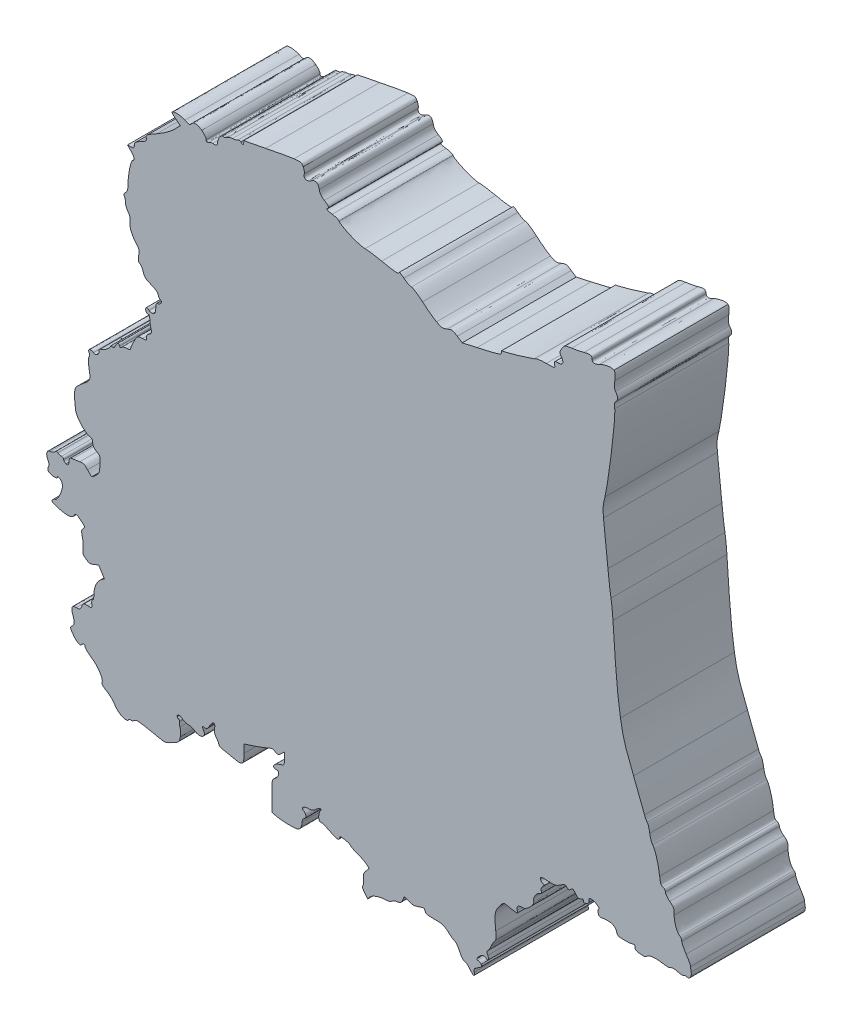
SolidWorks part; units mm, degrees
ref_plane "Plan de face" through (0, 0, 0) normal (1, 0, 0) x (0, 1, 0)
ref_plane "Plan de dessus" through (0, 0, 0) normal (0, 0, 1) x (0, 1, 0)
ref_plane "Plan de droite" through (0, 0, 0) normal (0, 1, 0) x (-1, 0, 0)
sketch "Esquisse1" plane through (0, 0, 0) normal (0, 0, 1) x (0, 1, 0)
  line L0 (-281.1932, -2.654) -> (-281.313, -2.5585)
  line L1 (-281.313, -2.5585) -> (-281.147, -2.4238)
  line L2 (-280.2887, -2.4818) -> (-280.122, -2.622)
  line L3 (-280.122, -2.622) -> (-280.0138, -2.4921)
  line L4 (-280.1697, 1.4705) -> (-280.1142, 1.6503)
  line L5 (-280.1142, 1.6503) -> (-279.4885, 1.6503)
  line L6 (-277.8143, 1.0969) -> (-277.5578, 1.0969)
  line L7 (-277.5578, 1.0969) -> (-277.6876, 1.235)
  line L8 (-277.9887, 2.4113) -> (-278.1392, 2.8678)
  line L9 (-278.1392, 2.8678) -> (-278.4876, 2.8678)
  line L10 (-275.0081, 9.1102) -> (-274.9289, 8.9971)
  line L11 (-274.9289, 8.9971) -> (-274.7314, 9.1192)
  line L12 (-258.0872, 7.8322) -> (-257.932, 7.9809)
  line L13 (-257.932, 7.9809) -> (-257.932, 7.8322)
  line L14 (-256.3209, 5.9341) -> (-256.0468, 5.664)
  line L15 (-256.0468, 5.664) -> (-255.9062, 5.8436)
  line L16 (-257.9679, -6.4873) -> (-258.11, -6.702)
  line L17 (-258.11, -6.702) -> (-257.9649, -7.354)
  line L18 (-277.2068, -16.7182) -> (-277.207, -16.7189)
  spline S0 degree 3 poles (-277.207, -16.7189) (-277.2699, -16.6813) (-277.2944, -16.6224) (-277.2738, -16.5577) knots 0 0 0 0 1 1 1 1
  spline S1 degree 3 poles (-277.2738, -16.5577) (-277.2561, -16.5016) (-277.2636, -16.4419) (-277.2917, -16.4247) knots 0 0 0 0 1 1 1 1
  spline S2 degree 3 poles (-277.2917, -16.4247) (-277.3213, -16.4064) (-277.3173, -16.3011) (-277.2815, -16.1687) knots 0 0 0 0 1 1 1 1
  spline S3 degree 3 poles (-277.2815, -16.1687) (-277.2394, -16.0116) (-277.2389, -15.916) (-277.2785, -15.852) knots 0 0 0 0 1 1 1 1
  spline S4 degree 3 poles (-277.2785, -15.852) (-277.3166, -15.7916) (-277.3193, -15.6664) (-277.2865, -15.4847) knots 0 0 0 0 1 1 1 1
  spline S5 degree 3 poles (-277.2865, -15.4847) (-277.2298, -15.1731) (-277.2702, -14.8656) (-277.3759, -14.8016) knots 0 0 0 0 1 1 1 1
  spline S6 degree 3 poles (-277.3759, -14.8016) (-277.4226, -14.7732) (-277.4389, -14.6778) (-277.4232, -14.5234) knots 0 0 0 0 1 1 1 1
  spline S7 degree 3 poles (-277.4232, -14.5234) (-277.4039, -14.3325) (-277.3784, -14.2881) (-277.288, -14.2881) knots 0 0 0 0 1 1 1 1
  spline S8 degree 3 poles (-277.288, -14.2881) (-277.1982, -14.2881) (-277.1841, -14.2642) (-277.2148, -14.1636) knots 0 0 0 0 1 1 1 1
  spline S9 degree 3 poles (-277.2148, -14.1636) (-277.2358, -14.095) (-277.25, -14.0018) (-277.2466, -13.9561) knots 0 0 0 0 1 1 1 1
  spline S10 degree 3 poles (-277.2466, -13.9561) (-277.2426, -13.9105) (-277.2416, -13.7926) (-277.2426, -13.6942) knots 0 0 0 0 1 1 1 1
  spline S11 degree 3 poles (-277.2426, -13.6942) (-277.2436, -13.5474) (-277.2195, -13.509) (-277.1027, -13.4797) knots 0 0 0 0 1 1 1 1
  spline S12 degree 3 poles (-277.1027, -13.4797) (-276.9227, -13.4344) (-276.8392, -13.2233) (-276.8837, -12.9255) knots 0 0 0 0 1 1 1 1
  spline S13 degree 3 poles (-276.8837, -12.9255) (-276.9142, -12.7213) (-276.9047, -12.6939) (-276.7929, -12.6647) knots 0 0 0 0 1 1 1 1
  spline S14 degree 3 poles (-276.7929, -12.6647) (-276.7242, -12.6466) (-276.6517, -12.6577) (-276.6316, -12.691) knots 0 0 0 0 1 1 1 1
  spline S15 degree 3 poles (-276.6316, -12.691) (-276.5804, -12.7739) (-276.415, -12.5233) (-276.415, -12.3628) knots 0 0 0 0 1 1 1 1
  spline S16 degree 3 poles (-276.415, -12.3628) (-276.415, -12.2621) (-276.4378, -12.2402) (-276.5165, -12.2653) knots 0 0 0 0 1 1 1 1
  spline S17 degree 3 poles (-276.5165, -12.2653) (-276.5888, -12.2884) (-276.6361, -12.2573) (-276.6813, -12.1584) knots 0 0 0 0 1 1 1 1
  spline S18 degree 3 poles (-276.6813, -12.1584) (-276.7338, -12.043) (-276.7303, -12.0192) (-276.661, -12.0192) knots 0 0 0 0 1 1 1 1
  spline S19 degree 3 poles (-276.661, -12.0192) (-276.5936, -12.0192) (-276.5892, -11.997) (-276.6381, -11.9055) knots 0 0 0 0 1 1 1 1
  spline S20 degree 3 poles (-276.6381, -11.9055) (-276.6894, -11.8097) (-276.6761, -11.7738) (-276.5541, -11.6778) knots 0 0 0 0 1 1 1 1
  spline S21 degree 3 poles (-276.5541, -11.6778) (-276.4226, -11.5744) (-276.4171, -11.5553) (-276.4941, -11.4703) knots 0 0 0 0 1 1 1 1
  spline S22 degree 3 poles (-276.4941, -11.4703) (-276.5687, -11.3878) (-276.5691, -11.3668) (-276.4981, -11.2951) knots 0 0 0 0 1 1 1 1
  spline S23 degree 3 poles (-276.4981, -11.2951) (-276.4263, -11.2233) (-276.4338, -11.1883) (-276.5608, -11.0015) knots 0 0 0 0 1 1 1 1
  spline S24 degree 3 poles (-276.5608, -11.0015) (-276.6856, -10.8178) (-276.7018, -10.7456) (-276.6815, -10.4635) knots 0 0 0 0 1 1 1 1
  spline S25 degree 3 poles (-276.6815, -10.4635) (-276.6613, -10.184) (-276.6712, -10.1376) (-276.7524, -10.1376) knots 0 0 0 0 1 1 1 1
  spline S26 degree 3 poles (-276.7524, -10.1376) (-276.8044, -10.1376) (-276.8625, -10.1783) (-276.8816, -10.2282) knots 0 0 0 0 1 1 1 1
  spline S27 degree 3 poles (-276.8816, -10.2282) (-276.9137, -10.3118) (-276.9241, -10.3117) (-277.0178, -10.2272) knots 0 0 0 0 1 1 1 1
  spline S28 degree 3 poles (-277.0178, -10.2272) (-277.0769, -10.1738) (-277.1589, -10.1506) (-277.2137, -10.1715) knots 0 0 0 0 1 1 1 1
  spline S29 degree 3 poles (-277.2137, -10.1715) (-277.2804, -10.1972) (-277.317, -10.1736) (-277.3386, -10.0909) knots 0 0 0 0 1 1 1 1
  spline S30 degree 3 poles (-277.3386, -10.0909) (-277.3727, -9.9603) (-277.6541, -9.7963) (-277.7686, -9.8402) knots 0 0 0 0 1 1 1 1
  spline S31 degree 3 poles (-277.7686, -9.8402) (-277.8902, -9.8868) (-278.2421, -9.5392) (-278.2431, -9.3714) knots 0 0 0 0 1 1 1 1
  spline S32 degree 3 poles (-278.2431, -9.3714) (-278.2441, -9.1531) (-278.3177, -9.068) (-278.4648, -9.1147) knots 0 0 0 0 1 1 1 1
  spline S33 degree 3 poles (-278.4648, -9.1147) (-278.5843, -9.1527) (-278.5887, -9.1441) (-278.5547, -8.9407) knots 0 0 0 0 1 1 1 1
  spline S34 degree 3 poles (-278.5547, -8.9407) (-278.535, -8.8231) (-278.5066, -8.6771) (-278.4915, -8.6162) knots 0 0 0 0 1 1 1 1
  spline S35 degree 3 poles (-278.4915, -8.6162) (-278.4709, -8.533) (-278.5262, -8.4601) (-278.714, -8.323) knots 0 0 0 0 1 1 1 1
  spline S36 degree 3 poles (-278.714, -8.323) (-278.9844, -8.1257) (-279.1736, -8.0979) (-279.7241, -8.1748) knots 0 0 0 0 1 1 1 1
  spline S37 degree 3 poles (-279.7241, -8.1748) (-279.9464, -8.2058) (-280.039, -8.1961) (-280.1115, -8.1344) knots 0 0 0 0 1 1 1 1
  spline S38 degree 3 poles (-280.1115, -8.1344) (-280.1639, -8.0899) (-280.287, -8.0217) (-280.3849, -7.9829) knots 0 0 0 0 1 1 1 1
  spline S39 degree 3 poles (-280.3849, -7.9829) (-280.4829, -7.944) (-280.5905, -7.8792) (-280.6243, -7.8385) knots 0 0 0 0 1 1 1 1
  spline S40 degree 3 poles (-280.6243, -7.8385) (-280.6717, -7.7815) (-280.7163, -7.7785) (-280.82, -7.8256) knots 0 0 0 0 1 1 1 1
  spline S41 degree 3 poles (-280.82, -7.8256) (-280.9677, -7.8929) (-281.064, -7.8462) (-280.9705, -7.7526) knots 0 0 0 0 1 1 1 1
  spline S42 degree 3 poles (-280.9705, -7.7526) (-280.8868, -7.6689) (-280.9391, -7.5258) (-281.0962, -7.4097) knots 0 0 0 0 1 1 1 1
  spline S43 degree 3 poles (-281.0962, -7.4097) (-281.203, -7.3308) (-281.2307, -7.3265) (-281.2307, -7.389) knots 0 0 0 0 1 1 1 1
  spline S44 degree 3 poles (-281.2307, -7.389) (-281.2307, -7.4324) (-281.2654, -7.4966) (-281.3079, -7.5319) knots 0 0 0 0 1 1 1 1
  spline S45 degree 3 poles (-281.3079, -7.5319) (-281.3698, -7.5834) (-281.4096, -7.5563) (-281.5087, -7.3961) knots 0 0 0 0 1 1 1 1
  spline S46 degree 3 poles (-281.5087, -7.3961) (-281.6101, -7.2322) (-281.6559, -7.2022) (-281.7635, -7.2291) knots 0 0 0 0 1 1 1 1
  spline S47 degree 3 poles (-281.7635, -7.2291) (-281.9448, -7.2747) (-281.9278, -7.1771) (-281.7288, -7.0299) knots 0 0 0 0 1 1 1 1
  spline S48 degree 3 poles (-281.7288, -7.0299) (-281.6374, -6.9624) (-281.5628, -6.8639) (-281.5628, -6.811) knots 0 0 0 0 1 1 1 1
  spline S49 degree 3 poles (-281.5628, -6.811) (-281.5628, -6.7499) (-281.4625, -6.668) (-281.2883, -6.5862) knots 0 0 0 0 1 1 1 1
  spline S50 degree 3 poles (-281.2883, -6.5862) (-281.1374, -6.5156) (-281.0129, -6.4265) (-281.0116, -6.3885) knots 0 0 0 0 1 1 1 1
  spline S51 degree 3 poles (-281.0116, -6.3885) (-281.0106, -6.3504) (-280.9236, -6.2246) (-280.8188, -6.1086) knots 0 0 0 0 1 1 1 1
  spline S52 degree 3 poles (-280.8188, -6.1086) (-280.6767, -5.9513) (-280.6275, -5.8459) (-280.6252, -5.6934) knots 0 0 0 0 1 1 1 1
  spline S53 degree 3 poles (-280.6252, -5.6934) (-280.6162, -5.1185) (-280.6135, -5.1066) (-280.5114, -5.074) knots 0 0 0 0 1 1 1 1
  spline S54 degree 3 poles (-280.5114, -5.074) (-280.4155, -5.0436) (-280.4142, -5.0263) (-280.4911, -4.8007) knots 0 0 0 0 1 1 1 1
  spline S55 degree 3 poles (-280.4911, -4.8007) (-280.5639, -4.5869) (-280.5637, -4.5374) (-280.4881, -4.358) knots 0 0 0 0 1 1 1 1
  spline S56 degree 3 poles (-280.4881, -4.358) (-280.4104, -4.1719) (-280.4111, -4.1537) (-280.4985, -4.1268) knots 0 0 0 0 1 1 1 1
  spline S57 degree 3 poles (-280.4985, -4.1268) (-280.7027, -4.064) (-280.7602, -4.005) (-280.7766, -3.8412) knots 0 0 0 0 1 1 1 1
  spline S58 degree 3 poles (-280.7766, -3.8412) (-280.7856, -3.7475) (-280.8296, -3.6412) (-280.8735, -3.6048) knots 0 0 0 0 1 1 1 1
  spline S59 degree 3 poles (-280.8735, -3.6048) (-280.9174, -3.5685) (-280.9534, -3.4607) (-280.9536, -3.3654) knots 0 0 0 0 1 1 1 1
  spline S60 degree 3 poles (-280.9536, -3.3654) (-280.954, -3.0846) (-281.0645, -2.7567) (-281.1932, -2.654) knots 0 0 0 0 1 1 1 1
  spline S61 degree 3 poles (-281.147, -2.4238) (-281.0269, -2.3264) (-280.9617, -2.3052) (-280.9113, -2.3466) knots 0 0 0 0 1 1 1 1
  spline S62 degree 3 poles (-280.9113, -2.3466) (-280.8729, -2.3784) (-280.7548, -2.3901) (-280.6485, -2.3729) knots 0 0 0 0 1 1 1 1
  spline S63 degree 3 poles (-280.6485, -2.3729) (-280.4944, -2.3479) (-280.4217, -2.3708) (-280.2887, -2.4818) knots 0 0 0 0 1 1 1 1
  spline S64 degree 3 poles (-280.0138, -2.4921) (-279.9543, -2.4206) (-279.8654, -2.244) (-279.8163, -2.0996) knots 0 0 0 0 1 1 1 1
  spline S65 degree 3 poles (-279.8163, -2.0996) (-279.7672, -1.9552) (-279.6948, -1.8183) (-279.6554, -1.7953) knots 0 0 0 0 1 1 1 1
  spline S66 degree 3 poles (-279.6554, -1.7953) (-279.5859, -1.7547) (-279.5057, -1.3392) (-279.567, -1.3375) knots 0 0 0 0 1 1 1 1
  spline S67 degree 3 poles (-279.567, -1.3375) (-279.5837, -1.3371) (-279.6306, -1.3156) (-279.6713, -1.2898) knots 0 0 0 0 1 1 1 1
  spline S68 degree 3 poles (-279.6713, -1.2898) (-279.7299, -1.2526) (-279.7092, -1.1716) (-279.5707, -0.8975) knots 0 0 0 0 1 1 1 1
  spline S69 degree 3 poles (-279.5707, -0.8975) (-279.4748, -0.7075) (-279.409, -0.519) (-279.4245, -0.4785) knots 0 0 0 0 1 1 1 1
  spline S70 degree 3 poles (-279.4245, -0.4785) (-279.4586, -0.3896) (-279.1384, -0.3811) (-279.0288, -0.4679) knots 0 0 0 0 1 1 1 1
  spline S71 degree 3 poles (-279.0288, -0.4679) (-278.8864, -0.581) (-278.8906, -0.4467) (-279.0338, -0.297) knots 0 0 0 0 1 1 1 1
  spline S72 degree 3 poles (-279.0338, -0.297) (-279.1383, -0.188) (-279.182, -0.0837) (-279.182, 0.0563) knots 0 0 0 0 1 1 1 1
  spline S73 degree 3 poles (-279.182, 0.0563) (-279.182, 0.265) (-279.3242, 0.3932) (-279.3837, 0.2381) knots 0 0 0 0 1 1 1 1
  spline S74 degree 3 poles (-279.3837, 0.2381) (-279.4246, 0.1312) (-279.619, 0.132) (-279.6601, 0.239) knots 0 0 0 0 1 1 1 1
  spline S75 degree 3 poles (-279.6601, 0.239) (-279.6775, 0.2846) (-279.7584, 0.3221) (-279.8397, 0.3221) knots 0 0 0 0 1 1 1 1
  spline S76 degree 3 poles (-279.8397, 0.3221) (-279.9209, 0.3221) (-280.0405, 0.3592) (-280.1052, 0.4046) knots 0 0 0 0 1 1 1 1
  spline S77 degree 3 poles (-280.1052, 0.4046) (-280.2067, 0.4757) (-280.2231, 0.5424) (-280.224, 0.8888) knots 0 0 0 0 1 1 1 1
  spline S78 degree 3 poles (-280.224, 0.8888) (-280.2245, 1.1098) (-280.2002, 1.3715) (-280.1697, 1.4705) knots 0 0 0 0 1 1 1 1
  spline S79 degree 3 poles (-279.4885, 1.6503) (-278.891, 1.6503) (-278.8588, 1.6433) (-278.7767, 1.5191) knots 0 0 0 0 1 1 1 1
  spline S80 degree 3 poles (-278.7767, 1.5191) (-278.7294, 1.447) (-278.6269, 1.3756) (-278.5489, 1.3607) knots 0 0 0 0 1 1 1 1
  spline S81 degree 3 poles (-278.5489, 1.3607) (-278.4306, 1.3381) (-278.4072, 1.3537) (-278.4072, 1.4591) knots 0 0 0 0 1 1 1 1
  spline S82 degree 3 poles (-278.4072, 1.4591) (-278.4072, 1.6698) (-278.2109, 1.5648) (-278.1357, 1.3137) knots 0 0 0 0 1 1 1 1
  spline S83 degree 3 poles (-278.1357, 1.3137) (-278.0723, 1.102) (-278.0646, 1.0969) (-277.8143, 1.0969) knots 0 0 0 0 1 1 1 1
  spline S84 degree 3 poles (-277.6876, 1.235) (-277.8016, 1.3564) (-277.8089, 1.3891) (-277.7472, 1.5042) knots 0 0 0 0 1 1 1 1
  spline S85 degree 3 poles (-277.7472, 1.5042) (-277.6895, 1.612) (-277.6913, 1.6636) (-277.7575, 1.795) knots 0 0 0 0 1 1 1 1
  spline S86 degree 3 poles (-277.7575, 1.795) (-277.8019, 1.8829) (-277.906, 2.1602) (-277.9887, 2.4113) knots 0 0 0 0 1 1 1 1
  spline S87 degree 3 poles (-278.4876, 2.8678) (-278.9424, 2.8678) (-278.9989, 2.9291) (-278.9082, 3.325) knots 0 0 0 0 1 1 1 1
  spline S88 degree 3 poles (-278.9082, 3.325) (-278.8717, 3.4845) (-278.8284, 3.6959) (-278.8119, 3.7948) knots 0 0 0 0 1 1 1 1
  spline S89 degree 3 poles (-278.8119, 3.7948) (-278.7954, 3.8936) (-278.7507, 3.9747) (-278.7125, 3.9747) knots 0 0 0 0 1 1 1 1
  spline S90 degree 3 poles (-278.7125, 3.9747) (-278.6743, 3.9747) (-278.5799, 4.0243) (-278.5027, 4.0851) knots 0 0 0 0 1 1 1 1
  spline S91 degree 3 poles (-278.5027, 4.0851) (-278.4024, 4.164) (-278.3153, 4.1862) (-278.1975, 4.1626) knots 0 0 0 0 1 1 1 1
  spline S92 degree 3 poles (-278.1975, 4.1626) (-277.9428, 4.1117) (-277.9373, 4.2294) (-278.1886, 4.3703) knots 0 0 0 0 1 1 1 1
  spline S93 degree 3 poles (-278.1886, 4.3703) (-278.3506, 4.4614) (-278.4068, 4.5247) (-278.3882, 4.5956) knots 0 0 0 0 1 1 1 1
  spline S94 degree 3 poles (-278.3882, 4.5956) (-278.3583, 4.7103) (-278.3752, 4.7153) (-278.5253, 4.6351) knots 0 0 0 0 1 1 1 1
  spline S95 degree 3 poles (-278.5253, 4.6351) (-278.7507, 4.5145) (-278.8857, 4.8185) (-278.71, 5.0508) knots 0 0 0 0 1 1 1 1
  spline S96 degree 3 poles (-278.71, 5.0508) (-278.6653, 5.1099) (-278.6287, 5.2234) (-278.6287, 5.3031) knots 0 0 0 0 1 1 1 1
  spline S97 degree 3 poles (-278.6287, 5.3031) (-278.6287, 5.3828) (-278.5921, 5.4963) (-278.5475, 5.5554) knots 0 0 0 0 1 1 1 1
  spline S98 degree 3 poles (-278.5475, 5.5554) (-278.4421, 5.6949) (-278.4413, 5.8011) (-278.5465, 5.8011) knots 0 0 0 0 1 1 1 1
  spline S99 degree 3 poles (-278.5465, 5.8011) (-278.5921, 5.8011) (-278.6296, 5.774) (-278.6296, 5.7411) knots 0 0 0 0 1 1 1 1
  spline S100 degree 3 poles (-278.6296, 5.7411) (-278.6296, 5.7082) (-278.6607, 5.6921) (-278.6988, 5.7055) knots 0 0 0 0 1 1 1 1
  spline S101 degree 3 poles (-278.6988, 5.7055) (-278.7369, 5.7189) (-278.8282, 5.7075) (-278.9015, 5.6804) knots 0 0 0 0 1 1 1 1
  spline S102 degree 3 poles (-278.9015, 5.6804) (-278.975, 5.6532) (-279.1385, 5.6464) (-279.2649, 5.6655) knots 0 0 0 0 1 1 1 1
  spline S103 degree 3 poles (-279.2649, 5.6655) (-279.476, 5.6972) (-279.5086, 5.7256) (-279.6628, 6.0135) knots 0 0 0 0 1 1 1 1
  spline S104 degree 3 poles (-279.6628, 6.0135) (-279.8066, 6.2816) (-279.8236, 6.3549) (-279.7808, 6.5206) knots 0 0 0 0 1 1 1 1
  spline S105 degree 3 poles (-279.7808, 6.5206) (-279.7532, 6.6271) (-279.6958, 6.9128) (-279.653, 7.1555) knots 0 0 0 0 1 1 1 1
  spline S106 degree 3 poles (-279.653, 7.1555) (-279.5839, 7.548) (-279.5848, 7.6071) (-279.661, 7.6916) knots 0 0 0 0 1 1 1 1
  spline S107 degree 3 poles (-279.661, 7.6916) (-279.7083, 7.7438) (-279.7315, 7.8114) (-279.7127, 7.842) knots 0 0 0 0 1 1 1 1
  spline S108 degree 3 poles (-279.7127, 7.842) (-279.6939, 7.8723) (-279.7167, 7.9187) (-279.7627, 7.9445) knots 0 0 0 0 1 1 1 1
  spline S109 degree 3 poles (-279.7627, 7.9445) (-279.9021, 8.0224) (-279.7188, 8.4119) (-279.4829, 8.539) knots 0 0 0 0 1 1 1 1
  spline S110 degree 3 poles (-279.4829, 8.539) (-279.3788, 8.5949) (-279.2297, 8.7501) (-279.1514, 8.8838) knots 0 0 0 0 1 1 1 1
  spline S111 degree 3 poles (-279.1514, 8.8838) (-279.0479, 9.0605) (-278.9831, 9.1185) (-278.9139, 9.0965) knots 0 0 0 0 1 1 1 1
  spline S112 degree 3 poles (-278.9139, 9.0965) (-278.7464, 9.0434) (-278.4026, 9.2694) (-278.2054, 9.5622) knots 0 0 0 0 1 1 1 1
  spline S113 degree 3 poles (-278.2054, 9.5622) (-278.1021, 9.7156) (-277.9809, 9.8412) (-277.936, 9.8412) knots 0 0 0 0 1 1 1 1
  spline S114 degree 3 poles (-277.936, 9.8412) (-277.8432, 9.8412) (-277.8268, 9.9282) (-277.9098, 9.9795) knots 0 0 0 0 1 1 1 1
  spline S115 degree 3 poles (-277.9098, 9.9795) (-278.025, 10.0506) (-277.9549, 10.2064) (-277.7393, 10.359) knots 0 0 0 0 1 1 1 1
  spline S116 degree 3 poles (-277.7393, 10.359) (-277.5454, 10.4962) (-277.507, 10.5063) (-277.4499, 10.4346) knots 0 0 0 0 1 1 1 1
  spline S117 degree 3 poles (-277.4499, 10.4346) (-277.3488, 10.3078) (-277.238, 10.2935) (-276.9991, 10.3765) knots 0 0 0 0 1 1 1 1
  spline S118 degree 3 poles (-276.9991, 10.3765) (-276.7192, 10.4741) (-276.637, 10.4398) (-276.637, 10.2253) knots 0 0 0 0 1 1 1 1
  spline S119 degree 3 poles (-276.637, 10.2253) (-276.637, 10.0837) (-276.6067, 10.0413) (-276.4678, 9.9889) knots 0 0 0 0 1 1 1 1
  spline S120 degree 3 poles (-276.4678, 9.9889) (-276.3183, 9.9325) (-276.3005, 9.9026) (-276.3141, 9.7308) knots 0 0 0 0 1 1 1 1
  spline S121 degree 3 poles (-276.3141, 9.7308) (-276.329, 9.5433) (-276.3231, 9.5371) (-276.1511, 9.5506) knots 0 0 0 0 1 1 1 1
  spline S122 degree 3 poles (-276.1511, 9.5506) (-276.053, 9.5586) (-275.9728, 9.54) (-275.9728, 9.5092) knots 0 0 0 0 1 1 1 1
  spline S123 degree 3 poles (-275.9728, 9.5092) (-275.9728, 9.4787) (-275.8575, 9.4536) (-275.7165, 9.4536) knots 0 0 0 0 1 1 1 1
  spline S124 degree 3 poles (-275.7165, 9.4536) (-275.4431, 9.4536) (-275.1487, 9.3109) (-275.0081, 9.1102) knots 0 0 0 0 1 1 1 1
  spline S125 degree 3 poles (-274.7314, 9.1192) (-274.6228, 9.1862) (-274.5339, 9.2488) (-274.5339, 9.258) knots 0 0 0 0 1 1 1 1
  spline S126 degree 3 poles (-274.5339, 9.258) (-274.5339, 9.267) (-274.5689, 9.3581) (-274.6117, 9.4599) knots 0 0 0 0 1 1 1 1
  spline S127 degree 3 poles (-274.6117, 9.4599) (-274.6827, 9.6288) (-274.6797, 9.6587) (-274.5761, 9.8042) knots 0 0 0 0 1 1 1 1
  spline S128 degree 3 poles (-274.5761, 9.8042) (-274.4774, 9.9429) (-274.4373, 9.9594) (-274.2666, 9.9317) knots 0 0 0 0 1 1 1 1
  spline S129 degree 3 poles (-274.2666, 9.9317) (-274.1588, 9.9142) (-273.9624, 9.9277) (-273.8301, 9.9605) knots 0 0 0 0 1 1 1 1
  spline S130 degree 3 poles (-273.8301, 9.9605) (-273.6265, 10.0119) (-273.5741, 10.007) (-273.4876, 9.9286) knots 0 0 0 0 1 1 1 1
  spline S131 degree 3 poles (-273.4876, 9.9286) (-273.3913, 9.8413) (-273.3775, 9.8459) (-273.2403, 10.0089) knots 0 0 0 0 1 1 1 1
  spline S132 degree 3 poles (-273.2403, 10.0089) (-273.066, 10.2161) (-273.0612, 10.2617) (-273.2057, 10.3391) knots 0 0 0 0 1 1 1 1
  spline S133 degree 3 poles (-273.2057, 10.3391) (-273.3448, 10.4134) (-273.3535, 10.7086) (-273.2275, 11.0782) knots 0 0 0 0 1 1 1 1
  spline S134 degree 3 poles (-273.2275, 11.0782) (-273.1551, 11.2907) (-273.1244, 11.3272) (-273.0615, 11.275) knots 0 0 0 0 1 1 1 1
  spline S135 degree 3 poles (-273.0615, 11.275) (-273.019, 11.2398) (-272.9843, 11.1815) (-272.9843, 11.1458) knots 0 0 0 0 1 1 1 1
  spline S136 degree 3 poles (-272.9843, 11.1458) (-272.9843, 11.0546) (-272.5168, 10.8372) (-272.3206, 10.8372) knots 0 0 0 0 1 1 1 1
  spline S137 degree 3 poles (-272.3206, 10.8372) (-272.2146, 10.8372) (-272.1374, 10.8758) (-272.0988, 10.9479) knots 0 0 0 0 1 1 1 1
  spline S138 degree 3 poles (-272.0988, 10.9479) (-272.0586, 11.023) (-272.058, 11.0586) (-272.0976, 11.0586) knots 0 0 0 0 1 1 1 1
  spline S139 degree 3 poles (-272.0976, 11.0586) (-272.1844, 11.0586) (-272.1661, 11.3677) (-272.0748, 11.4436) knots 0 0 0 0 1 1 1 1
  spline S140 degree 3 poles (-272.0748, 11.4436) (-272.0193, 11.4895) (-271.9645, 11.4931) (-271.8966, 11.4552) knots 0 0 0 0 1 1 1 1
  spline S141 degree 3 poles (-271.8966, 11.4552) (-271.8281, 11.4169) (-271.7549, 11.423) (-271.6532, 11.4756) knots 0 0 0 0 1 1 1 1
  spline S142 degree 3 poles (-271.6532, 11.4756) (-271.4561, 11.5777) (-271.2694, 11.5229) (-271.2694, 11.3634) knots 0 0 0 0 1 1 1 1
  spline S143 degree 3 poles (-271.2694, 11.3634) (-271.2694, 11.2945) (-271.2309, 11.2064) (-271.184, 11.1675) knots 0 0 0 0 1 1 1 1
  spline S144 degree 3 poles (-271.184, 11.1675) (-271.1248, 11.1184) (-271.1164, 11.0789) (-271.1563, 11.0389) knots 0 0 0 0 1 1 1 1
  spline S145 degree 3 poles (-271.1563, 11.0389) (-271.188, 11.0071) (-271.214, 10.9364) (-271.214, 10.8816) knots 0 0 0 0 1 1 1 1
  spline S146 degree 3 poles (-271.214, 10.8816) (-271.214, 10.8267) (-271.2484, 10.782) (-271.2905, 10.782) knots 0 0 0 0 1 1 1 1
  spline S147 degree 3 poles (-271.2905, 10.782) (-271.3327, 10.782) (-271.3798, 10.7336) (-271.3952, 10.6744) knots 0 0 0 0 1 1 1 1
  spline S148 degree 3 poles (-271.3952, 10.6744) (-271.4182, 10.5867) (-271.3913, 10.5636) (-271.2495, 10.5498) knots 0 0 0 0 1 1 1 1
  spline S149 degree 3 poles (-271.2495, 10.5498) (-271.1084, 10.5361) (-271.074, 10.5069) (-271.0668, 10.3946) knots 0 0 0 0 1 1 1 1
  spline S150 degree 3 poles (-271.0668, 10.3946) (-271.0616, 10.3185) (-271.0402, 10.1757) (-271.0186, 10.0772) knots 0 0 0 0 1 1 1 1
  spline S151 degree 3 poles (-271.0186, 10.0772) (-270.9845, 9.9224) (-271.0026, 9.8764) (-271.152, 9.7368) knots 0 0 0 0 1 1 1 1
  spline S152 degree 3 poles (-271.152, 9.7368) (-271.2469, 9.648) (-271.3247, 9.5641) (-271.3247, 9.5503) knots 0 0 0 0 1 1 1 1
  spline S153 degree 3 poles (-271.3247, 9.5503) (-271.3247, 9.5366) (-271.2588, 9.454) (-271.1781, 9.3671) knots 0 0 0 0 1 1 1 1
  spline S154 degree 3 poles (-271.1781, 9.3671) (-271.054, 9.2331) (-270.9799, 9.2057) (-270.6939, 9.1879) knots 0 0 0 0 1 1 1 1
  spline S155 degree 3 poles (-270.6939, 9.1879) (-270.366, 9.1673) (-270.3534, 9.1718) (-270.2563, 9.338) knots 0 0 0 0 1 1 1 1
  spline S156 degree 3 poles (-270.2563, 9.338) (-270.1832, 9.4631) (-270.1156, 9.5091) (-270.0052, 9.5091) knots 0 0 0 0 1 1 1 1
  spline S157 degree 3 poles (-270.0052, 9.5091) (-269.89, 9.5091) (-269.8519, 9.5376) (-269.845, 9.6287) knots 0 0 0 0 1 1 1 1
  spline S158 degree 3 poles (-269.845, 9.6287) (-269.8307, 9.8188) (-269.4077, 10.2123) (-269.1739, 10.253) knots 0 0 0 0 1 1 1 1
  spline S159 degree 3 poles (-269.1739, 10.253) (-268.7888, 10.3199) (-268.4185, 10.3242) (-268.3007, 10.2636) knots 0 0 0 0 1 1 1 1
  spline S160 degree 3 poles (-268.3007, 10.2636) (-268.2355, 10.2296) (-268.0793, 10.071) (-267.9535, 9.9112) knots 0 0 0 0 1 1 1 1
  spline S161 degree 3 poles (-267.9535, 9.9112) (-267.709, 9.6005) (-267.6792, 9.5907) (-267.2323, 9.6754) knots 0 0 0 0 1 1 1 1
  spline S162 degree 3 poles (-267.2323, 9.6754) (-267.034, 9.7131) (-266.909, 9.7117) (-266.8338, 9.6724) knots 0 0 0 0 1 1 1 1
  spline S163 degree 3 poles (-266.8338, 9.6724) (-266.7561, 9.631) (-266.7031, 9.6314) (-266.6513, 9.6734) knots 0 0 0 0 1 1 1 1
  spline S164 degree 3 poles (-266.6513, 9.6734) (-266.5533, 9.7548) (-266.483, 9.5813) (-266.5711, 9.4751) knots 0 0 0 0 1 1 1 1
  spline S165 degree 3 poles (-266.5711, 9.4751) (-266.6513, 9.3786) (-266.5439, 9.2331) (-266.3924, 9.2331) knots 0 0 0 0 1 1 1 1
  spline S166 degree 3 poles (-266.3924, 9.2331) (-266.3353, 9.2331) (-266.2886, 9.2035) (-266.2886, 9.1675) knots 0 0 0 0 1 1 1 1
  spline S167 degree 3 poles (-266.2886, 9.1675) (-266.2886, 9.0651) (-266.0474, 8.736) (-265.9721, 8.7355) knots 0 0 0 0 1 1 1 1
  spline S168 degree 3 poles (-265.9721, 8.7355) (-265.935, 8.7353) (-265.9188, 8.6983) (-265.9362, 8.6532) knots 0 0 0 0 1 1 1 1
  spline S169 degree 3 poles (-265.9362, 8.6532) (-265.9563, 8.601) (-265.9157, 8.5479) (-265.8237, 8.506) knots 0 0 0 0 1 1 1 1
  spline S170 degree 3 poles (-265.8237, 8.506) (-265.6675, 8.4348) (-265.6404, 8.3713) (-265.7489, 8.3314) knots 0 0 0 0 1 1 1 1
  spline S171 degree 3 poles (-265.7489, 8.3314) (-265.8042, 8.3112) (-265.8042, 8.2913) (-265.7489, 8.2327) knots 0 0 0 0 1 1 1 1
  spline S172 degree 3 poles (-265.7489, 8.2327) (-265.7107, 8.1923) (-265.6797, 8.0897) (-265.6797, 8.0045) knots 0 0 0 0 1 1 1 1
  spline S173 degree 3 poles (-265.6797, 8.0045) (-265.6797, 7.9184) (-265.6494, 7.8495) (-265.6114, 7.8495) knots 0 0 0 0 1 1 1 1
  spline S174 degree 3 poles (-265.6114, 7.8495) (-265.5738, 7.8495) (-265.412, 7.7809) (-265.2518, 7.6973) knots 0 0 0 0 1 1 1 1
  spline S175 degree 3 poles (-265.2518, 7.6973) (-264.9769, 7.5536) (-264.9605, 7.5331) (-264.9604, 7.3311) knots 0 0 0 0 1 1 1 1
  spline S176 degree 3 poles (-264.9604, 7.3311) (-264.9603, 7.1461) (-264.9457, 7.121) (-264.8521, 7.1454) knots 0 0 0 0 1 1 1 1
  spline S177 degree 3 poles (-264.8521, 7.1454) (-264.7786, 7.1645) (-264.7155, 7.1303) (-264.6553, 7.0384) knots 0 0 0 0 1 1 1 1
  spline S178 degree 3 poles (-264.6553, 7.0384) (-264.5886, 6.9364) (-264.5374, 6.9124) (-264.4478, 6.9409) knots 0 0 0 0 1 1 1 1
  spline S179 degree 3 poles (-264.4478, 6.9409) (-264.3483, 6.9726) (-264.2039, 6.994) (-263.9502, 7.0159) knots 0 0 0 0 1 1 1 1
  spline S180 degree 3 poles (-263.9502, 7.0159) (-263.9272, 7.0168) (-263.9088, 7.0568) (-263.9088, 7.1024) knots 0 0 0 0 1 1 1 1
  spline S181 degree 3 poles (-263.9088, 7.1024) (-263.9088, 7.1486) (-263.8595, 7.1855) (-263.7981, 7.1855) knots 0 0 0 0 1 1 1 1
  spline S182 degree 3 poles (-263.7981, 7.1855) (-263.675, 7.1855) (-263.656, 7.1284) (-263.7482, 7.0361) knots 0 0 0 0 1 1 1 1
  spline S183 degree 3 poles (-263.7482, 7.0361) (-263.7816, 7.0027) (-263.7924, 6.9229) (-263.7722, 6.859) knots 0 0 0 0 1 1 1 1
  spline S184 degree 3 poles (-263.7722, 6.859) (-263.7428, 6.7668) (-263.6901, 6.7428) (-263.5177, 6.7428) knots 0 0 0 0 1 1 1 1
  spline S185 degree 3 poles (-263.5177, 6.7428) (-263.3697, 6.7428) (-263.3, 6.7185) (-263.3, 6.6666) knots 0 0 0 0 1 1 1 1
  spline S186 degree 3 poles (-263.3, 6.6666) (-263.3, 6.6246) (-263.2646, 6.5609) (-263.2216, 6.5252) knots 0 0 0 0 1 1 1 1
  spline S187 degree 3 poles (-263.2216, 6.5252) (-263.1604, 6.4744) (-263.1329, 6.4775) (-263.0971, 6.5399) knots 0 0 0 0 1 1 1 1
  spline S188 degree 3 poles (-263.0971, 6.5399) (-263.072, 6.5839) (-263.0022, 6.6289) (-262.9423, 6.6401) knots 0 0 0 0 1 1 1 1
  spline S189 degree 3 poles (-262.9423, 6.6401) (-262.8703, 6.6536) (-262.7961, 6.757) (-262.7233, 6.9453) knots 0 0 0 0 1 1 1 1
  spline S190 degree 3 poles (-262.7233, 6.9453) (-262.6286, 7.1901) (-262.5847, 7.2387) (-262.4091, 7.2913) knots 0 0 0 0 1 1 1 1
  spline S191 degree 3 poles (-262.4091, 7.2913) (-262.2967, 7.325) (-262.1895, 7.3924) (-262.1708, 7.4412) knots 0 0 0 0 1 1 1 1
  spline S192 degree 3 poles (-262.1708, 7.4412) (-262.1435, 7.5124) (-262.0882, 7.5226) (-261.8895, 7.4928) knots 0 0 0 0 1 1 1 1
  spline S193 degree 3 poles (-261.8895, 7.4928) (-261.6817, 7.4618) (-261.6222, 7.4746) (-261.5166, 7.5744) knots 0 0 0 0 1 1 1 1
  spline S194 degree 3 poles (-261.5166, 7.5744) (-261.2935, 7.7851) (-260.9881, 7.9121) (-260.7925, 7.8754) knots 0 0 0 0 1 1 1 1
  spline S195 degree 3 poles (-260.7925, 7.8754) (-260.6589, 7.8504) (-260.576, 7.8724) (-260.4675, 7.9563) knots 0 0 0 0 1 1 1 1
  spline S196 degree 3 poles (-260.4675, 7.9563) (-260.3873, 8.0193) (-260.2499, 8.0709) (-260.1619, 8.0709) knots 0 0 0 0 1 1 1 1
  spline S197 degree 3 poles (-260.1619, 8.0709) (-260.0739, 8.0709) (-259.9763, 8.0964) (-259.9452, 8.1276) knots 0 0 0 0 1 1 1 1
  spline S198 degree 3 poles (-259.9452, 8.1276) (-259.9066, 8.1662) (-259.8563, 8.1486) (-259.7872, 8.0722) knots 0 0 0 0 1 1 1 1
  spline S199 degree 3 poles (-259.7872, 8.0722) (-259.7141, 7.9912) (-259.6165, 7.9602) (-259.436, 7.9602) knots 0 0 0 0 1 1 1 1
  spline S200 degree 3 poles (-259.436, 7.9602) (-259.054, 7.9602) (-258.4631, 7.8441) (-258.4135, 7.7592) knots 0 0 0 0 1 1 1 1
  spline S201 degree 3 poles (-258.4135, 7.7592) (-258.3479, 7.6468) (-258.2604, 7.6664) (-258.0872, 7.8322) knots 0 0 0 0 1 1 1 1
  spline S202 degree 3 poles (-257.932, 7.8322) (-257.932, 7.7107) (-257.907, 7.6834) (-257.7946, 7.6834) knots 0 0 0 0 1 1 1 1
  spline S203 degree 3 poles (-257.7946, 7.6834) (-257.6852, 7.6834) (-257.6285, 7.6267) (-257.5166, 7.406) knots 0 0 0 0 1 1 1 1
  spline S204 degree 3 poles (-257.5166, 7.406) (-257.3985, 7.1731) (-257.3562, 7.1332) (-257.2528, 7.1576) knots 0 0 0 0 1 1 1 1
  spline S205 degree 3 poles (-257.2528, 7.1576) (-257.1453, 7.183) (-257.0955, 7.124) (-256.8623, 6.6954) knots 0 0 0 0 1 1 1 1
  spline S206 degree 3 poles (-256.8623, 6.6954) (-256.7114, 6.418) (-256.4757, 6.0865) (-256.3209, 5.9341) knots 0 0 0 0 1 1 1 1
  spline S207 degree 3 poles (-255.9062, 5.8436) (-255.8288, 5.9423) (-255.7441, 6.0232) (-255.7178, 6.0232) knots 0 0 0 0 1 1 1 1
  spline S208 degree 3 poles (-255.7178, 6.0232) (-255.6261, 6.0232) (-255.6336, 5.6619) (-255.7295, 5.4613) knots 0 0 0 0 1 1 1 1
  spline S209 degree 3 poles (-255.7295, 5.4613) (-255.8129, 5.2869) (-255.8151, 5.2502) (-255.7468, 5.1935) knots 0 0 0 0 1 1 1 1
  spline S210 degree 3 poles (-255.7468, 5.1935) (-255.5951, 5.0675) (-255.5959, 4.9248) (-255.7488, 4.7235) knots 0 0 0 0 1 1 1 1
  spline S211 degree 3 poles (-255.7488, 4.7235) (-255.8304, 4.6164) (-255.945, 4.5289) (-256.0033, 4.5289) knots 0 0 0 0 1 1 1 1
  spline S212 degree 3 poles (-256.0033, 4.5289) (-256.0924, 4.5289) (-256.0998, 4.5112) (-256.0499, 4.4177) knots 0 0 0 0 1 1 1 1
  spline S213 degree 3 poles (-256.0499, 4.4177) (-256.0171, 4.3564) (-255.9944, 4.2755) (-255.9991, 4.2378) knots 0 0 0 0 1 1 1 1
  spline S214 degree 3 poles (-255.9991, 4.2378) (-256.0192, 4.0806) (-255.9874, 4.0309) (-255.8688, 4.0309) knots 0 0 0 0 1 1 1 1
  spline S215 degree 3 poles (-255.8688, 4.0309) (-255.7041, 4.0309) (-255.4817, 3.8733) (-255.5169, 3.7815) knots 0 0 0 0 1 1 1 1
  spline S216 degree 3 poles (-255.5169, 3.7815) (-255.5321, 3.742) (-255.5089, 3.6636) (-255.4671, 3.6074) knots 0 0 0 0 1 1 1 1
  spline S217 degree 3 poles (-255.4671, 3.6074) (-255.4245, 3.5512) (-255.389, 3.4475) (-255.388, 3.377) knots 0 0 0 0 1 1 1 1
  spline S218 degree 3 poles (-255.388, 3.377) (-255.3871, 3.3065) (-255.3613, 3.2022) (-255.3307, 3.1451) knots 0 0 0 0 1 1 1 1
  spline S219 degree 3 poles (-255.3307, 3.1451) (-255.2936, 3.0757) (-255.2936, 3.0301) (-255.3307, 3.0072) knots 0 0 0 0 1 1 1 1
  spline S220 degree 3 poles (-255.3307, 3.0072) (-255.4182, 2.9532) (-255.3955, 2.8686) (-255.3032, 2.9039) knots 0 0 0 0 1 1 1 1
  spline S221 degree 3 poles (-255.3032, 2.9039) (-255.2576, 2.9214) (-255.2201, 2.9119) (-255.2201, 2.8825) knots 0 0 0 0 1 1 1 1
  spline S222 degree 3 poles (-255.2201, 2.8825) (-255.2201, 2.8531) (-255.1359, 2.421) (-255.0326, 1.922) knots 0 0 0 0 1 1 1 1
  spline S223 degree 3 poles (-255.0326, 1.922) (-254.9294, 1.423) (-254.828, 0.8642) (-254.8071, 0.6803) knots 0 0 0 0 1 1 1 1
  spline S224 degree 3 poles (-254.8071, 0.6803) (-254.7711, 0.3622) (-254.7759, 0.3424) (-254.9079, 0.2717) knots 0 0 0 0 1 1 1 1
  spline S225 degree 3 poles (-254.9079, 0.2717) (-254.9842, 0.2308) (-255.0982, 0.2109) (-255.1612, 0.2273) knots 0 0 0 0 1 1 1 1
  spline S226 degree 3 poles (-255.1612, 0.2273) (-255.3388, 0.2738) (-255.399, 0.1091) (-255.2702, -0.0716) knots 0 0 0 0 1 1 1 1
  spline S227 degree 3 poles (-255.2702, -0.0716) (-255.1333, -0.2638) (-255.1835, -0.3847) (-255.4182, -0.4287) knots 0 0 0 0 1 1 1 1
  spline S228 degree 3 poles (-255.4182, -0.4287) (-255.5512, -0.4536) (-255.6394, -0.5184) (-255.7217, -0.6516) knots 0 0 0 0 1 1 1 1
  spline S229 degree 3 poles (-255.7217, -0.6516) (-255.8466, -0.8538) (-255.8841, -0.8724) (-255.9777, -0.7787) knots 0 0 0 0 1 1 1 1
  spline S230 degree 3 poles (-255.9777, -0.7787) (-256.0215, -0.7348) (-256.0487, -0.7949) (-256.0764, -0.996) knots 0 0 0 0 1 1 1 1
  spline S231 degree 3 poles (-256.0764, -0.996) (-256.0974, -1.1487) (-256.1459, -1.2857) (-256.1845, -1.3005) knots 0 0 0 0 1 1 1 1
  spline S232 degree 3 poles (-256.1845, -1.3005) (-256.3204, -1.3526) (-256.67, -2.1791) (-256.6661, -2.4392) knots 0 0 0 0 1 1 1 1
  spline S233 degree 3 poles (-256.6661, -2.4392) (-256.6641, -2.5734) (-256.7115, -2.9031) (-256.7713, -3.1719) knots 0 0 0 0 1 1 1 1
  spline S234 degree 3 poles (-256.7713, -3.1719) (-256.8938, -3.722) (-256.9078, -3.9384) (-256.8208, -3.9384) knots 0 0 0 0 1 1 1 1
  spline S235 degree 3 poles (-256.8208, -3.9384) (-256.7881, -3.9384) (-256.8379, -4.0313) (-256.9315, -4.1447) knots 0 0 0 0 1 1 1 1
  spline S236 degree 3 poles (-256.9315, -4.1447) (-257.0252, -4.2582) (-257.1015, -4.4062) (-257.1015, -4.4736) knots 0 0 0 0 1 1 1 1
  spline S237 degree 3 poles (-257.1015, -4.4736) (-257.1015, -4.5438) (-257.2382, -4.7525) (-257.4214, -4.962) knots 0 0 0 0 1 1 1 1
  spline S238 degree 3 poles (-257.4214, -4.962) (-257.5973, -5.1632) (-257.8002, -5.439) (-257.8722, -5.5747) knots 0 0 0 0 1 1 1 1
  spline S239 degree 3 poles (-257.8722, -5.5747) (-257.9985, -5.8126) (-258, -5.8297) (-257.9145, -6.0471) knots 0 0 0 0 1 1 1 1
  spline S240 degree 3 poles (-257.9145, -6.0471) (-257.8279, -6.2674) (-257.8292, -6.2777) (-257.9679, -6.4873) knots 0 0 0 0 1 1 1 1
  spline S241 degree 3 poles (-257.9649, -7.354) (-257.7559, -8.293) (-257.7151, -8.4211) (-257.6246, -8.4211) knots 0 0 0 0 1 1 1 1
  spline S242 degree 3 poles (-257.6246, -8.4211) (-257.5804, -8.4211) (-257.5441, -8.4281) (-257.544, -8.4349) knots 0 0 0 0 1 1 1 1
  spline S243 degree 3 poles (-257.544, -8.4349) (-257.543, -8.5639) (-257.1902, -9.7896) (-257.1297, -9.876) knots 0 0 0 0 1 1 1 1
  spline S244 degree 3 poles (-257.1297, -9.876) (-257.0741, -9.9552) (-257.0461, -10.1276) (-257.0461, -10.3904) knots 0 0 0 0 1 1 1 1
  spline S245 degree 3 poles (-257.0461, -10.3904) (-257.0461, -10.7819) (-257.0451, -10.7852) (-256.9077, -10.759) knots 0 0 0 0 1 1 1 1
  spline S246 degree 3 poles (-256.9077, -10.759) (-256.7838, -10.7353) (-256.7694, -10.751) (-256.7694, -10.9068) knots 0 0 0 0 1 1 1 1
  spline S247 degree 3 poles (-256.7694, -10.9068) (-256.7694, -11.1216) (-256.652, -11.1774) (-256.462, -11.053) knots 0 0 0 0 1 1 1 1
  spline S248 degree 3 poles (-256.462, -11.053) (-256.3291, -10.966) (-256.3115, -10.9671) (-256.1341, -11.0769) knots 0 0 0 0 1 1 1 1
  spline S249 degree 3 poles (-256.1341, -11.0769) (-255.9673, -11.1799) (-255.9423, -11.2276) (-255.9078, -11.5087) knots 0 0 0 0 1 1 1 1
  spline S250 degree 3 poles (-255.9078, -11.5087) (-255.8865, -11.6825) (-255.8392, -11.9246) (-255.8029, -12.0466) knots 0 0 0 0 1 1 1 1
  spline S251 degree 3 poles (-255.8029, -12.0466) (-255.7239, -12.3121) (-255.7461, -12.4058) (-255.8885, -12.4058) knots 0 0 0 0 1 1 1 1
  spline S252 degree 3 poles (-255.8885, -12.4058) (-256.0144, -12.4058) (-256.0242, -12.52) (-255.9163, -12.7287) knots 0 0 0 0 1 1 1 1
  spline S253 degree 3 poles (-255.9163, -12.7287) (-255.8002, -12.9531) (-255.7507, -13.2805) (-255.8202, -13.3642) knots 0 0 0 0 1 1 1 1
  spline S254 degree 3 poles (-255.8202, -13.3642) (-255.8635, -13.4163) (-255.9673, -13.4257) (-256.2, -13.3988) knots 0 0 0 0 1 1 1 1
  spline S255 degree 3 poles (-256.2, -13.3988) (-256.4215, -13.373) (-256.5459, -13.3828) (-256.6033, -13.4298) knots 0 0 0 0 1 1 1 1
  spline S256 degree 3 poles (-256.6033, -13.4298) (-256.7493, -13.5499) (-256.8495, -13.5564) (-256.9636, -13.4532) knots 0 0 0 0 1 1 1 1
  spline S257 degree 3 poles (-256.9636, -13.4532) (-257.0513, -13.374) (-257.1163, -13.3616) (-257.2695, -13.3963) knots 0 0 0 0 1 1 1 1
  spline S258 degree 3 poles (-257.2695, -13.3963) (-257.5087, -13.4502) (-260.183, -13.1268) (-260.837, -12.9648) knots 0 0 0 0 1 1 1 1
  spline S259 degree 3 poles (-260.837, -12.9648) (-261.1971, -12.8757) (-261.352, -12.8637) (-261.6671, -12.9022) knots 0 0 0 0 1 1 1 1
  spline S260 degree 3 poles (-261.6671, -12.9022) (-262.1121, -12.9563) (-262.3472, -12.9813) (-263.4934, -13.0973) knots 0 0 0 0 1 1 1 1
  spline S261 degree 3 poles (-263.4934, -13.0973) (-263.95, -13.1435) (-264.4231, -13.2036) (-264.5449, -13.2312) knots 0 0 0 0 1 1 1 1
  spline S262 degree 3 poles (-264.5449, -13.2312) (-264.6667, -13.2586) (-265.0277, -13.2977) (-265.3474, -13.3175) knots 0 0 0 0 1 1 1 1
  spline S263 degree 3 poles (-265.3474, -13.3175) (-267.1486, -13.4304) (-268.1743, -13.5256) (-268.8937, -13.6466) knots 0 0 0 0 1 1 1 1
  spline S264 degree 3 poles (-268.8937, -13.6466) (-269.6085, -13.7669) (-269.8267, -13.8327) (-270.803, -14.2217) knots 0 0 0 0 1 1 1 1
  spline S265 degree 3 poles (-270.803, -14.2217) (-271.4093, -14.4633) (-271.9676, -14.6795) (-272.0437, -14.7021) knots 0 0 0 0 1 1 1 1
  spline S266 degree 3 poles (-272.0437, -14.7021) (-272.1198, -14.7247) (-272.2213, -14.7777) (-272.2691, -14.8195) knots 0 0 0 0 1 1 1 1
  spline S267 degree 3 poles (-272.2691, -14.8195) (-272.3171, -14.8615) (-272.4789, -14.9115) (-272.6289, -14.9309) knots 0 0 0 0 1 1 1 1
  spline S268 degree 3 poles (-272.6289, -14.9309) (-272.7788, -14.9503) (-272.9513, -15.0087) (-273.0122, -15.0608) knots 0 0 0 0 1 1 1 1
  spline S269 degree 3 poles (-273.0122, -15.0608) (-273.1492, -15.1779) (-273.6292, -15.3199) (-274.0443, -15.3661) knots 0 0 0 0 1 1 1 1
  spline S270 degree 3 poles (-274.0443, -15.3661) (-274.2903, -15.3934) (-274.3629, -15.4238) (-274.385, -15.5083) knots 0 0 0 0 1 1 1 1
  spline S271 degree 3 poles (-274.385, -15.5083) (-274.4008, -15.5689) (-274.4608, -15.6157) (-274.5224, -15.6157) knots 0 0 0 0 1 1 1 1
  spline S272 degree 3 poles (-274.5224, -15.6157) (-274.5825, -15.6157) (-274.6982, -15.703) (-274.7794, -15.8094) knots 0 0 0 0 1 1 1 1
  spline S273 degree 3 poles (-274.7794, -15.8094) (-274.9135, -15.9852) (-274.9527, -16.0031) (-275.2038, -16.0031) knots 0 0 0 0 1 1 1 1
  spline S274 degree 3 poles (-275.2038, -16.0031) (-275.4846, -16.0031) (-275.7985, -16.1223) (-275.8789, -16.2596) knots 0 0 0 0 1 1 1 1
  spline S275 degree 3 poles (-275.8789, -16.2596) (-275.9033, -16.301) (-275.9723, -16.3352) (-276.0324, -16.3352) knots 0 0 0 0 1 1 1 1
  spline S276 degree 3 poles (-276.0324, -16.3352) (-276.0926, -16.3352) (-276.2684, -16.4224) (-276.4233, -16.5289) knots 0 0 0 0 1 1 1 1
  spline S277 degree 3 poles (-276.4233, -16.5289) (-276.5782, -16.6354) (-276.7457, -16.723) (-276.7955, -16.7234) knots 0 0 0 0 1 1 1 1
  spline S278 degree 3 poles (-276.7955, -16.7234) (-276.8454, -16.7238) (-276.936, -16.7364) (-276.9968, -16.7508) knots 0 0 0 0 1 1 1 1
  spline S279 degree 3 poles (-276.9968, -16.7508) (-277.0577, -16.7654) (-277.1522, -16.7508) (-277.2068, -16.7182) knots 0 0 0 0 1 1 1 1
  spline S334 degree 3 poles (-268.2987, 14.1956) (-275.3768, 14.1956) (-281.7579, 9.9319) (-284.4666, 3.3926) knots 0 0 0 0 1 1 1 1 construction
  spline S335 degree 3 poles (-284.4666, 3.3926) (-287.1753, -3.1467) (-285.678, -10.6738) (-280.6731, -15.6787) knots 0 0 0 0 1 1 1 1 construction
  spline S336 degree 3 poles (-280.6731, -15.6787) (-275.6681, -20.6837) (-268.1411, -22.1809) (-261.6017, -19.4723) knots 0 0 0 0 1 1 1 1 construction
  spline S337 degree 3 poles (-261.6017, -19.4723) (-255.0624, -16.7636) (-250.7987, -10.3824) (-250.7987, -3.3044) knots 0 0 0 0 1 1 1 1 construction
  spline S338 degree 3 poles (-250.7987, -3.3044) (-250.7987, 1.3369) (-252.6425, 5.7881) (-255.9243, 9.07) knots 0 0 0 0 1 1 1 1 construction
  spline S339 degree 3 poles (-255.9243, 9.07) (-259.2062, 12.3519) (-263.6574, 14.1956) (-268.2987, 14.1956) knots 0 0 0 0 1 1 1 1 construction
extrude "Boss.-Extru.7" add sketch "Esquisse1" along normal blind 5
